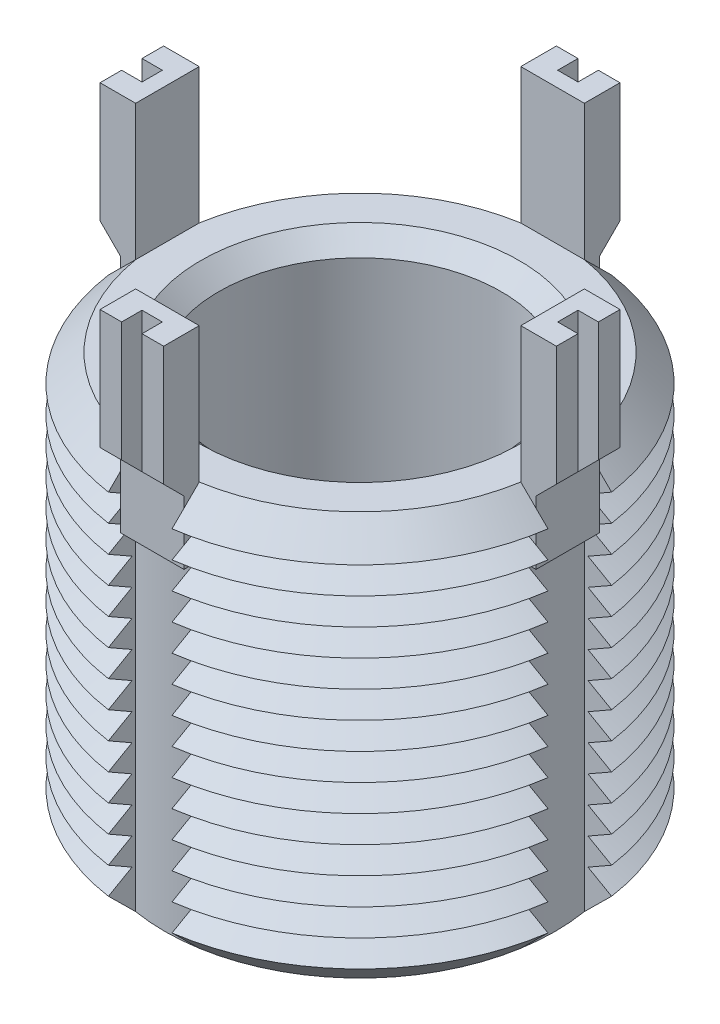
SolidWorks part; units mm, degrees
ref_plane "Front Plane" through (0, 0, 0) normal (0, 0, 1) x (1, 0, 0)
ref_plane "Top Plane" through (0, 0, 0) normal (0, 1, 0) x (1, 0, 0)
ref_plane "Right Plane" through (0, 0, 0) normal (1, 0, 0) x (0, 0, -1)
sketch "Sketch1" plane through (0, 0, 0) normal (0, 1, 0) x (1, 0, 0)
  circle A0 centre (0, 0) radius 17.4625
  dimension "D1" = 34.925
extrude "Boss-Extrude1" add sketch "Sketch1" against normal blind 31.75
chamfer "Chamfer1" distance 2.117 angle 45 2 edges at (0, -31.75, 17.4625) (0, 0, 17.4625)
sketch "Sketch2" plane through (0, 0, 0) normal (1, 0, 0) x (0, 0, -1)
  line L0 (0, 0.8859) -> (0, -9.2617) construction
sketch "Sketch3" plane through (0, 0, 0) normal (1, 0, 0) x (0, 0, -1)
  line L0 (-17.4625, -2.117) -> (-15.6291, -3.1755)
  line L1 (-15.6291, -3.1755) -> (-17.4625, -4.234)
  line L2 (-17.4625, -2.117) -> (-17.4625, -29.633) construction
  line L3 (-17.4625, -4.234) -> (-17.4625, -2.117)
  dimension "D1" = 2.117
revolve "Cut-Revolve1" cut sketch "Sketch3" angle 360 about L0
pattern_linear "LPattern1" count 13 spacing 2.117 along (0, -1, 0) of "Cut-Revolve1"
sketch "Sketch4" plane through (0, 0, 0) normal (0, 1, 0) x (1, 0, 0)
  line L0 (-15.1405, 2.5) -> (-17.2826, 2.5)
  line L2 (-17.2826, -2.5) -> (-15.1405, -2.5)
  arc A0 (-15.1405, 2.5) -> (-15.1405, -2.5) centre (0, 0) ccw
  arc A1 (-17.2826, 2.5) -> (-17.2826, -2.5) centre (0, 0) ccw
  circle A2 centre (0, 0) radius 17.4625 construction
  circle A3 centre (0, 0) radius 15.3455 construction
  point P1 (-15.3455, 0)
  point P3 (-17.4625, 0)
  point P13 (0, 0)
  dimension "D1" = 5
extrude "Cut-Extrude1" cut sketch "Sketch4" against normal up to surface (31.75 mm away)
pattern_circular "CirPattern1" count 4 over 360 about axis through (0, 0, 0) along (0, 1, 0) of "Cut-Extrude1"
sketch "Sketch5" plane through (0, 0, 0) normal (1, 0, 0) x (0, 0, -1)
  line L0 (-15.1405, 10.649) -> (-15.1405, -5.351)
  line L1 (-15.1405, -5.351) -> (-16.3405, -5.351)
  line L2 (-16.3405, -5.351) -> (-16.3405, -0.351)
  line L3 (-16.3405, -0.351) -> (-17.9405, 1.249)
  line L4 (-17.9405, 1.249) -> (-17.9405, 10.649)
  line L5 (-17.9405, 10.649) -> (-15.1405, 10.649)
  line L6 (-17.2826, -6.351) -> (-2.5, -6.351) construction
  point P9 (-2.5, 0)
  point P10 (-16.3405, -0.351)
  dimension "D1" = 1
  dimension "D2" = 16
  dimension "D3" = 11
  dimension "D4" = 2.8
  dimension "D5" = 1.2
  dimension "D6" = 45
extrude "Boss-Extrude3" add sketch "Sketch5" along normal mid plane 5
pattern_circular "CirPattern2" count 4 over 360 about axis through (0, 0, 0) along (0, 1, 0) of "Boss-Extrude3"
sketch "Sketch6" plane through (0, 10.649, 0) normal (0, 1, 0) x (1, 0, 0)
  line L0 (-17.9405, -2.5) -> (-17.9405, 2.5) construction
  line L1 (-17.9405, -0.8) -> (-16.3405, -0.8)
  line L2 (-17.9405, -0.8) -> (-17.9405, 0.8)
  line L3 (-17.9405, 0.8) -> (-16.3405, 0.8)
  line L4 (-16.3405, -0.8) -> (-16.3405, 0.8)
  line L5 (-17.9405, -0.8) -> (-16.3405, 0.8) construction
  line L6 (-17.9405, 0.8) -> (-16.3405, -0.8) construction
  line L7 (17.9405, 2.5) -> (17.9405, -2.5) construction
  line L8 (-0.8, 16.3405) -> (0.8, 16.3405)
  line L9 (-0.8, 16.3405) -> (-0.8, 17.9405)
  line L10 (-0.8, 17.9405) -> (0.8, 17.9405)
  line L11 (0.8, 16.3405) -> (0.8, 17.9405)
  line L12 (-0.8, 16.3405) -> (0.8, 17.9405) construction
  line L13 (-0.8, 17.9405) -> (0.8, 16.3405) construction
  line L14 (16.3405, -0.8) -> (17.9405, -0.8)
  line L15 (16.3405, -0.8) -> (16.3405, 0.8)
  line L16 (16.3405, 0.8) -> (17.9405, 0.8)
  line L17 (17.9405, -0.8) -> (17.9405, 0.8)
  line L18 (16.3405, -0.8) -> (17.9405, 0.8) construction
  line L19 (16.3405, 0.8) -> (17.9405, -0.8) construction
  line L20 (-0.8, -17.9405) -> (0.8, -17.9405)
  line L21 (-0.8, -17.9405) -> (-0.8, -16.3405)
  line L22 (-0.8, -16.3405) -> (0.8, -16.3405)
  line L23 (0.8, -17.9405) -> (0.8, -16.3405)
  line L24 (-0.8, -17.9405) -> (0.8, -16.3405) construction
  line L25 (-0.8, -16.3405) -> (0.8, -17.9405) construction
  line L26 (-2.5, 17.9405) -> (2.5, 17.9405) construction
  line L27 (2.5, -17.9405) -> (-2.5, -17.9405) construction
  point P0 (-17.1405, 0)
  point P7 (-17.9405, 0)
  point P8 (-17.9405, 0)
  point P9 (0, 17.1405)
  point P14 (17.1405, 0)
  point P19 (0, -17.1405)
  point P24 (0, 17.9405)
  point P25 (17.9405, 0)
  point P26 (17.9405, 0)
  point P27 (0, 17.9405)
  point P30 (0, -17.9405)
  point P33 (0, -17.9405)
  dimension "D1" = 1.6
  dimension "D2" = 1.6
extrude "Cut-Extrude3" cut sketch "Sketch6" against normal through all both and the other way through all
sketch "Sketch7" plane through (0, 0, 0) normal (0, 1, 0) x (1, 0, 0)
  circle A0 centre (0, 0) radius 11.1125
  dimension "D1" = 22.225
extrude "Cut-Extrude4" cut sketch "Sketch7" against normal up to surface (31.75 mm away)
chamfer "Chamfer2" distance 1.411 angle 45 2 edges at (0, 0, 11.1125) (0, -31.75, 11.1125)
